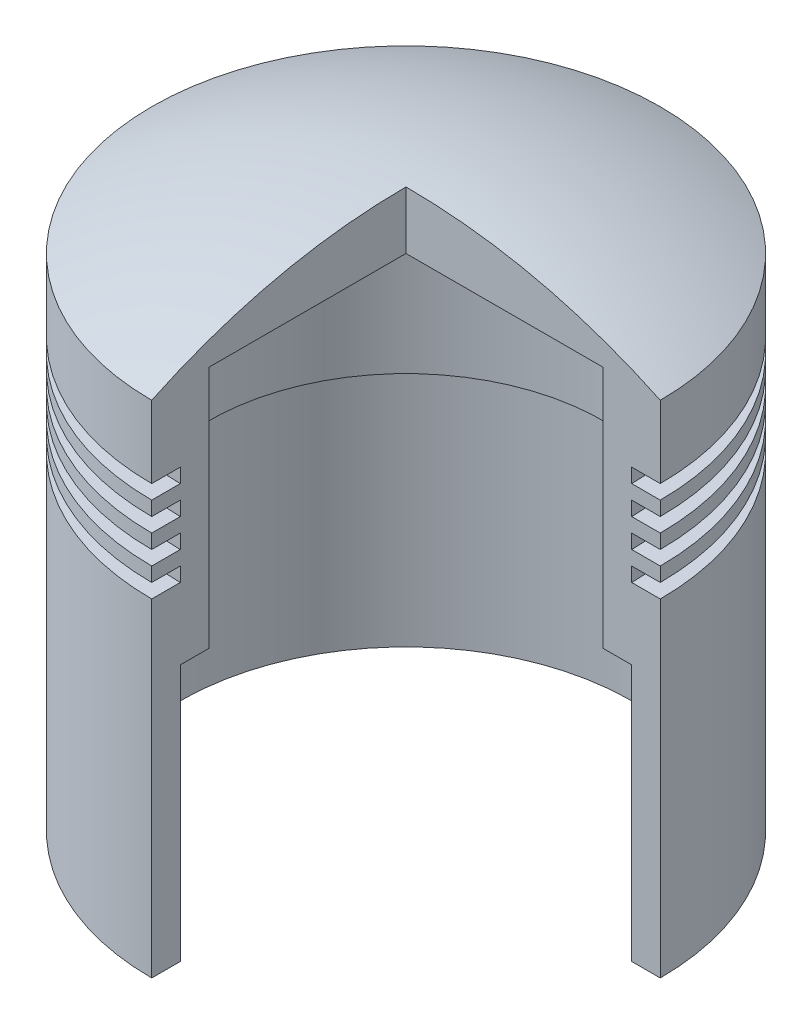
SolidWorks part; units mm, degrees
ref_plane "Plane1" through (0, 0, 0) normal (0, 0, 1) x (1, 0, 0)
ref_plane "Plane2" through (0, 0, 0) normal (0, 1, 0) x (1, 0, 0)
ref_plane "Plane3" through (0, 0, 0) normal (1, 0, 0) x (0, 0, -1)
sketch "Sketch1" plane through (0, 0, 0) normal (0, 0, 1) x (1, 0, 0)
  line L0 (34.5393, 89.9083) -> (0, 89.9083)
  line L1 (44.5393, 72.2641) -> (44.5393, 74.7641)
  line L2 (44.5393, 72.2641) -> (39.5393, 72.2641)
  line L3 (39.5393, 72.2641) -> (39.5393, 69.7641)
  line L4 (39.5393, 69.7641) -> (44.5393, 69.7641)
  line L5 (44.5393, 2.2641) -> (39.5393, 2.2641)
  line L6 (39.5393, 2.2641) -> (39.5393, 47.2641)
  line L7 (44.5393, 69.7641) -> (44.5393, 67.2641)
  line L9 (44.5393, 67.2641) -> (39.5393, 67.2641)
  line L10 (39.5393, 67.2641) -> (39.5393, 64.7641)
  line L11 (39.5393, 64.7641) -> (44.5393, 64.7641)
  line L12 (44.5393, 64.7641) -> (44.5393, 62.2641)
  line L13 (44.5393, 62.2641) -> (39.5393, 62.2641)
  line L14 (39.5393, 62.2641) -> (39.5393, 59.7641)
  line L15 (39.5393, 59.7641) -> (44.5393, 59.7641)
  line L16 (44.5393, 59.7641) -> (44.5393, 2.2641)
  line L17 (39.5393, 47.2641) -> (34.5393, 47.2641)
  line L18 (34.5393, 47.2641) -> (34.5393, 89.9083)
  line L19 (0, 89.9083) -> (0, 100)
  line L20 (44.5393, 74.7641) -> (39.5393, 74.7641)
  line L21 (39.5393, 74.7641) -> (39.5393, 77.2641)
  line L22 (39.5393, 77.2641) -> (44.5393, 77.2641)
  line L23 (44.5393, 77.2641) -> (44.5393, 89.9083)
  arc A0 (44.5393, 89.9083) -> (0, 100) centre (0, -3.3321) ccw
revolve "Revolve1" add sketch "Sketch1" angle 270 about L19
